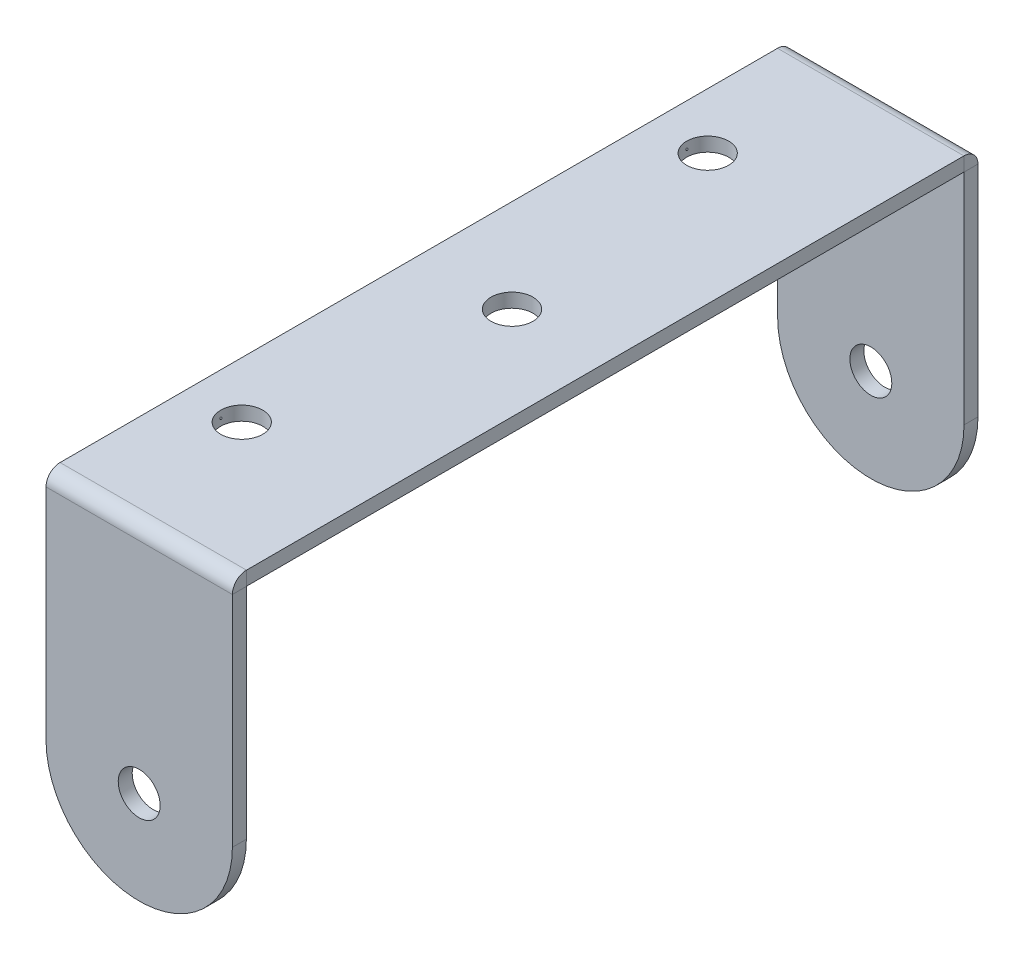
SolidWorks part; units mm, degrees
ref_plane "Front" through (0, 0, 0) normal (0, 0, 1) x (1, 0, 0)
ref_plane "Top" through (0, 0, 0) normal (0, 1, 0) x (1, 0, 0)
ref_plane "Right" through (0, 0, 0) normal (1, 0, 0) x (0, 0, -1)
sketch "Sketch1" plane through (0, 0, 0) normal (0, 1, 0) x (1, 0, 0)
  line L8 (0, 65) -> (0, -65)
  line L9 (20, -65) -> (20, 65)
  circle A0 centre (10, 65) radius 2.25
  circle A1 centre (10, -65) radius 2.25
  circle A2 centre (10, 0) radius 2.25
  circle A3 centre (6, 25) radius 2.25
  circle A4 centre (6, -25) radius 2.25
  arc A5 (20, 65) -> (0, 65) centre (10, 65) ccw
  arc A6 (0, -65) -> (20, -65) centre (10, -65) ccw
sheet metal parameters "Sheet-Metal1" thickness 1.5 parameters "D1"=0.01
base flange "Base-Flange1" sketch "Sketch1" thickness 1.5 reverse thickness direction yes parameters "D1"=0.01
sketch "Sketch4" plane through (0, 1.5, 0) normal (0, 1, 0) x (-1, 0, 0)
  line L3 (0, 40) -> (-20, 40)
  line L4 (0, -40) -> (-20, -40)
sketched bend "Sketched Bend1" parameters "D1"=0
bend "SketchBend1" bend radius 0.01 bend angle 90 parameters "D5"=1
bend "SketchBend2" bend radius 0 bend angle 90 parameters "D5"=2
ref_plane "Plane1" through (0, 0.75, 0) normal (0, 1, 0) x (-1, 0, 0)
sketch "Sketch5" plane through (0, 0.75, 0) normal (0, 1, 0) x (-1, 0, 0)
  line L0 (-3.75, 25.1) -> (-3.75, 24.9)
  arc A0 (-3.75, 25.1) -> (-3.75, 24.9) centre (-3.75, 25) ccw
  circle A1 centre (-6, 25) radius 2.25 construction
revolve "Revolve1" add sketch "Sketch5" angle 360 about L0
sketch "Sketch6" plane through (0, 0.75, 0) normal (0, 1, 0) x (-1, 0, 0)
  line L0 (-3.75, -24.9) -> (-3.75, -25.1)
  arc A0 (-3.75, -24.9) -> (-3.75, -25.1) centre (-3.75, -25) ccw
  circle A1 centre (-6, -25) radius 2.25 construction
revolve "Revolve2" add sketch "Sketch6" angle 360 about L0
flat pattern "Flat-Pattern1"
sketch "Bend-Lines1" plane through (0, 1.5, 0) normal (0, 1, 0) x (-1, 0, 0)
  line L0 (-20, -40) -> (0, -40) construction
  line L1 (-20, 40) -> (0, 40) construction
bend of the flat pattern "Flatten-<SketchBend1>1"
bend of the flat pattern "Flatten-<SketchBend2>1"
